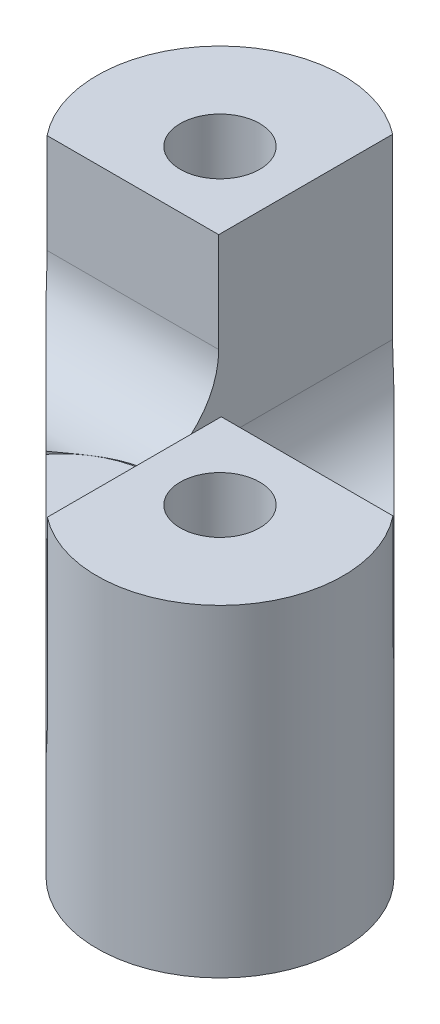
SolidWorks part; units mm, degrees
ref_plane "Спереди" through (0, 0, 0) normal (0, 0, 1) x (1, 0, 0)
ref_plane "Сверху" through (0, 0, 0) normal (0, 1, 0) x (1, 0, 0)
ref_plane "Справа" through (0, 0, 0) normal (1, 0, 0) x (0, 0, -1)
sketch "Эскиз1" plane through (0, 0, 0) normal (0, 1, 0) x (1, 0, 0)
  line L0 (-16.9094, 4.94) -> (-0.797, 4.94) construction
  line L1 (-3.4, 22.7767) -> (3.4, 22.7767) construction
  line L2 (-3.4, 22.7767) -> (-3.4, -22.7767) construction
  line L3 (-3.4, -22.7767) -> (3.4, -22.7767) construction
  line L4 (3.4, 22.7767) -> (3.4, -22.7767) construction
  line L5 (-22.7767, 3.4) -> (22.7767, 3.4) construction
  line L6 (-22.7767, 3.4) -> (-22.7767, -3.4) construction
  line L7 (-22.7767, -3.4) -> (22.7767, -3.4) construction
  line L8 (22.7767, 3.4) -> (22.7767, -3.4) construction
  line L9 (-4.94, 15.0974) -> (-4.94, 1.8458) construction
  line L10 (0, 0) -> (12.3139, 12.3139) construction
  line L11 (-2.92, 10.36) -> (10.36, -2.92)
  line L12 (-10.36, 2.92) -> (2.92, -10.36)
  circle A0 centre (-6.64, 6.64) radius 1.7
  circle A2 centre (-6.64, 6.64) radius 5.2609
  circle A3 centre (6.64, -6.64) radius 1.7
  circle A4 centre (6.64, -6.64) radius 5.2609
  point P8 (-22.7767, 0)
  point P9 (-3.4, 0)
  point P11 (0, 3.4)
  point P12 (0, 22.7767)
  dimension "D2" = 3.4
  dimension "D4" = 1.54
  dimension "D3" = 1.54
  dimension "D1" = 6.8
  dimension "D5" = 45
extrude "Бобышка-Вытянуть1" add sketch "Эскиз1" along normal blind 13.8 contours L12 A4 L11 A2 | A4 A3 | A2 A0
sketch "Эскиз2" plane through (0, 0, 0) normal (0, 0, 1) x (1, 0, 0)
  line L0 (17.3092, 0) -> (17.3092, 2.8) construction
  line L1 (17.3092, 2.8) -> (17.3092, 6.2) construction
  line L2 (17.3092, 2.8) -> (-8.8711, 2.8) construction
  line L3 (-3.4, 6.2) -> (-3.4, 20.8045)
  line L4 (-3.4, 20.8045) -> (3.4, 20.8045)
  line L5 (3.4, 20.8045) -> (3.4, 6.2)
  arc A0 (-3.4, 6.2) -> (3.4, 6.2) centre (0, 6.2) ccw
  point P4 (0, 0)
  dimension "D2" = 6.8
  dimension "D1" = 2.8
extrude "Вырез-Вытянуть1" cut sketch "Эскиз2" against normal through all both and the other way through all
sketch "Эскиз3" plane through (0, 0, 0) normal (1, 0, 0) x (0, 0, -1)
  line L0 (10.7848, 16.2182) -> (7.44, 16.2182)
  line L1 (7.44, 16.2182) -> (0, 16.2182)
  line L2 (0, 16.2182) -> (-3.3448, 16.2182)
  line L3 (-3.3448, 16.2182) -> (-3.3448, -1.7197)
  line L4 (3.3448, 16.2182) -> (3.3448, -0.1946)
  line L5 (15.6886, 6.2) -> (15.6886, 9.5448)
  circle A0 centre (0, 9.5448) radius 3.3448
  point P12 (0, 0)
  point P15 (0, 0)
  point P16 (0, 0)
  point P17 (0, 0)
  point P18 (0, 9.2749)
  point P19 (0, 0)
  point P20 (0, 0)
  dimension "D1" = 6.6896
extrude "Вырез-Вытянуть2" cut sketch "Эскиз3" against normal through all both and the other way through all contours A0 | A0 L4 L1 L2 L3
sketch "Эскиз4" plane through (0, 13.8, 0) normal (0, 1, 0) x (1, 0, 0)
  line L1 (-1.64, 13.3605) -> (1.64, 13.3605) construction
  line L2 (-1.64, 13.3605) -> (-1.64, -14.1198) construction
  line L3 (-1.64, -14.1198) -> (1.64, -14.1198) construction
  line L4 (1.64, 13.3605) -> (1.64, -14.1198) construction
  circle A0 centre (-6.64, 6.64) radius 5
  circle A1 centre (6.64, -6.64) radius 5
  circle A2 centre (3.4, 3.3448) radius 4
  circle A3 centre (-3.4, -3.3448) radius 4
  dimension "D1" = 18.7808
  dimension "D2" = 10
  dimension "D3" = 8
  dimension "D4" = 3.28
extrude "Вырез-Вытянуть3" cut sketch "Эскиз4" against normal up to vertex (7.6 mm away) contours A2 | A3
